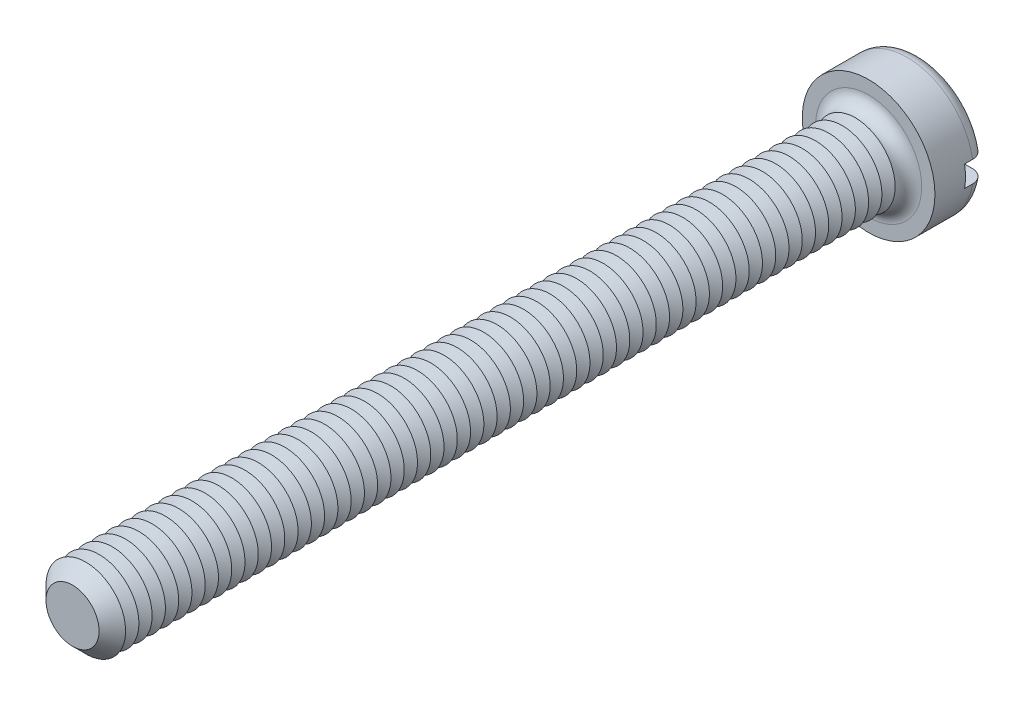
SolidWorks part; units mm, degrees
ref_plane "Front Plane" through (0, 0, 0) normal (0, 0, 1) x (1, 0, 0)
ref_plane "Top Plane" through (0, 0, 0) normal (0, 1, 0) x (1, 0, 0)
ref_plane "Right Plane" through (0, 0, 0) normal (1, 0, 0) x (0, 0, -1)
sketch "Sketch3" plane through (0, 0, 0) normal (0, 0, 1) x (1, 0, 0)
  circle A0 centre (0, 0) radius 5
  dimension "D1" = 10
extrude "Boss-Extrude2" add sketch "Sketch3" against normal blind 3.9
sketch "Sketch4" plane through (0, 0, 0) normal (0, 0, 1) x (1, 0, 0)
  circle A0 centre (0, 0) radius 3
  dimension "D1" = 6
extrude "Boss-Extrude3" add sketch "Sketch4" along normal blind 60
fillet "Fillet1" radius 1 2 edges at (5, 0, -3.9) (3, 0, 0)
chamfer "Chamfer1" distance 1 angle 45 1 edges at (3, 0, 60)
sketch "Sketch5" plane through (0, 0, 0) normal (1, 0, 0) x (0, 0, -1)
  line L0 (1.6944, 0) -> (-7.6738, 0) construction
sketch "Sketch6" plane through (0, 0, 0) normal (1, 0, 0) x (0, 0, -1)
  line L0 (-1, 3) -> (-1.5, 2.134)
  line L1 (-1.5, 2.134) -> (-2, 3)
  line L2 (-1, 3) -> (-59, 3) construction
  line L3 (-2, 3) -> (-1, 3)
  dimension "D1" = 1
revolve "Cut-Revolve1" cut sketch "Sketch6" angle 360 about L0
pattern_linear "LPattern1" count 58 spacing 1 along (0, 0, 1) of "Cut-Revolve1"
sketch "Sketch8" plane through (0, 0, -3.9) normal (0, 0, -1) x (-1, 0, 0)
  line L1 (5, -0.8) -> (-5, -0.8)
  line L2 (5, -0.8) -> (5, 0.8)
  line L3 (5, 0.8) -> (-5, 0.8)
  line L4 (-5, -0.8) -> (-5, 0.8)
  line L5 (5, -0.8) -> (-5, 0.8) construction
  line L6 (5, 0.8) -> (-5, -0.8) construction
  point P0 (0, 0)
  dimension "D1" = 10
  dimension "D2" = 1.6
extrude "Cut-Extrude1" cut sketch "Sketch8" against normal blind 1.6
